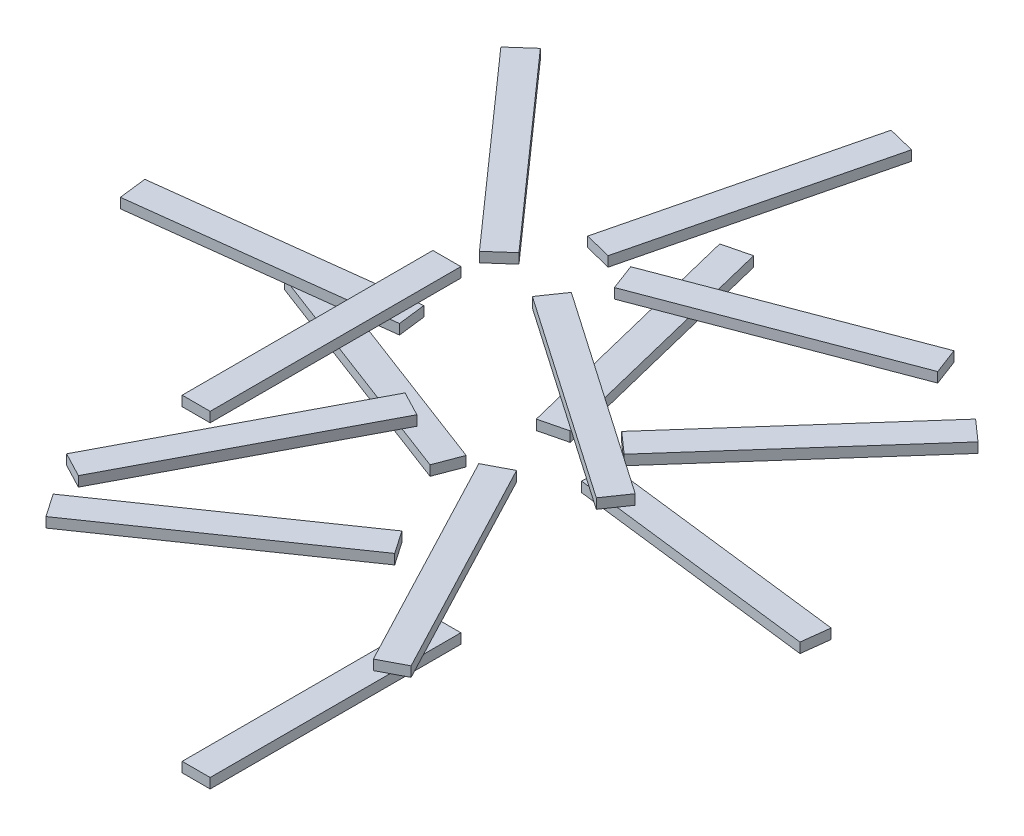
SolidWorks part; units mm, degrees
ref_plane "Ebene vorne" through (0, 0, 0) normal (0, 0, 1) x (1, 0, 0)
ref_plane "Ebene oben" through (0, 0, 0) normal (0, 1, 0) x (1, 0, 0)
ref_plane "Ebene rechts" through (0, 0, 0) normal (1, 0, 0) x (0, 0, -1)
sketch "Skizze3" plane through (0, 0, 0) normal (0, 1, 0) x (1, 0, 0)
  circle A0 centre (0, 0) radius 510.2154
curve "Spirale/Helix1"
sketch3d "3D-Skizze1"
  spline S1 degree 3 number of poles 208 (0, 0, 510.2154) -> (0, 2040, 510.2154)
  spline S2 degree 3 number of poles 208 (0, 0, 510.2154) -> (0, 2040, 510.2154)
  dimension "D1" = 0
sketch "Skizze4" plane through (0, 0, 0) normal (0, 1, 0) x (1, 0, 0)
  circle A0 centre (0, 0) radius 510.2154
surface "Oberfläche-Linear austragen1" sketch "Skizze4" parameters "D1"=1145.5
sketch "Skizze6" plane through (0, 0, 0) normal (1, 0, 0) x (0, 0, -1)
  line L1 (-510.2154, 0) -> (-2122.9265, 0)
  line L2 (-510.2154, 0) -> (-510.2154, -64.3279)
  line L3 (-510.2154, -64.3279) -> (-2122.9265, -64.3279)
  line L4 (-2122.9265, 0) -> (-2122.9265, -64.3279)
extrude "Linear austragen1" add sketch "Skizze6" along normal blind 180
pattern_curve "Kurvenmuster3" parameters "D1"=14, "D3"=50, "D2"=1, "D4"=50
equation "\"LÄNGE\"=0"
equation "\"BREITE\"=0"
equation "\"HÖHE\"=0"
equation "\"DURCHMESSER\"=0"
equation "\"Stückzahl\"= 1"
